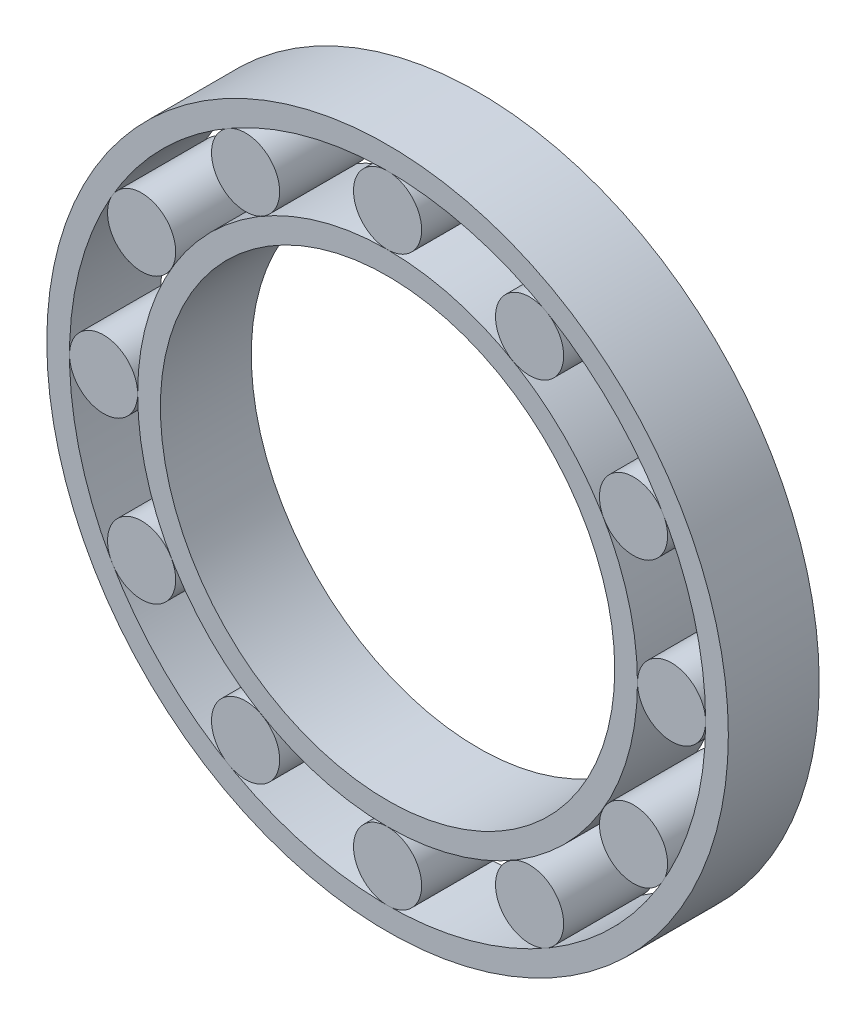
SolidWorks part; units mm, degrees
ref_plane "Front Plane" through (0, 0, 0) normal (0, 0, 1) x (1, 0, 0)
ref_plane "Top Plane" through (0, 0, 0) normal (0, 1, 0) x (1, 0, 0)
ref_plane "Right Plane" through (0, 0, 0) normal (1, 0, 0) x (0, 0, -1)
sketch "Sketch1" plane through (0, 0, 0) normal (0, 0, 1) x (1, 0, 0)
  circle A0 centre (0, 0) radius 6.35
  circle A1 centre (0, 0) radius 9.525
  circle A2 centre (0, 0) radius 6.985
  circle A3 centre (0, 0) radius 8.89
  dimension "D1" = 12.7
  dimension "D2" = 19.05
  dimension "D3" = 17.78
  dimension ".55" = 13.97
extrude "Boss-Extrude1" add sketch "Sketch1" along normal blind 2.54 contours A1 A3 | A2 A0
sketch "Sketch2" plane through (0, 0, 2.54) normal (0, 0, 1) x (1, 0, 0)
  line L0 (0, 15.3373) -> (0, -16.6359) construction
  line L1 (-18.3961, 0) -> (17.2418, 0) construction
  circle A0 centre (0, 7.9375) radius 0.9525
  circle A1 centre (0, 0) radius 6.985 construction
  circle A2 centre (0, 0) radius 8.89 construction
  circle A3 centre (3.9688, 6.8741) radius 0.9525
  circle A4 centre (6.8741, 3.9687) radius 0.9525
  circle A5 centre (7.9375, 0) radius 0.9525
  circle A6 centre (6.8741, -3.9687) radius 0.9525
  circle A7 centre (3.9688, -6.8741) radius 0.9525
  circle A8 centre (0, -7.9375) radius 0.9525
  circle A9 centre (-3.9687, -6.8741) radius 0.9525
  circle A10 centre (-6.8741, -3.9688) radius 0.9525
  circle A11 centre (-7.9375, 0) radius 0.9525
  circle A12 centre (-6.8741, 3.9688) radius 0.9525
  circle A13 centre (-3.9687, 6.8741) radius 0.9525
  point P35 (0, 0)
  dimension "D1" = 12
extrude "Boss-Extrude2" add sketch "Sketch2" against normal blind 2.54 separate body
